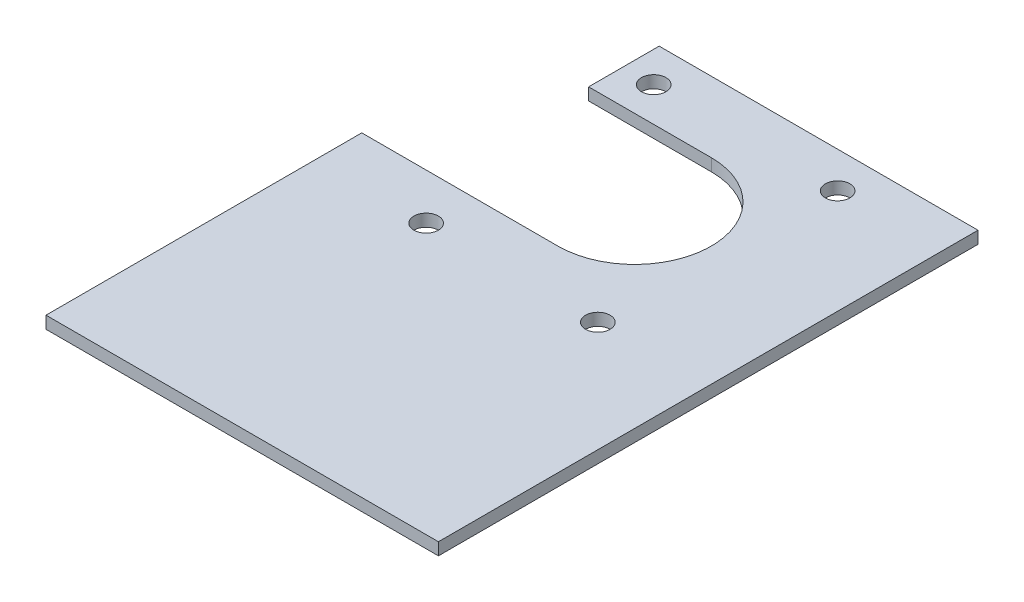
SolidWorks part; units mm, degrees
ref_plane "Front" through (0, 0, 0) normal (0, 0, 1) x (1, 0, 0)
ref_plane "Top" through (0, 0, 0) normal (0, 1, 0) x (1, 0, 0)
ref_plane "Right" through (0, 0, 0) normal (1, 0, 0) x (0, 0, -1)
sketch "Sketch1" plane through (0, 0, 0) normal (0, 1, 0) x (1, 0, 0)
  line L0 (25.4, 19.05) -> (-15.875, 19.05)
  line L2 (-25.4, -9.9219) -> (-25.4, -50.8)
  line L3 (-25.4, -50.8) -> (25.4, -50.8)
  line L4 (25.4, 19.05) -> (25.4, -50.8)
  line L5 (0, 0) -> (0, -50.8) construction
  line L6 (9.9219, 0) -> (15.875, 0) construction
  line L7 (0, -9.9219) -> (-25.4, -9.9219)
  line L10 (0, 9.9219) -> (-15.875, 9.9219)
  line L11 (-15.875, 9.9219) -> (-15.875, 19.05)
  line L12 (0, 15.875) -> (0, 9.9219) construction
  circle A0 centre (0, 0) radius 7.3025 construction
  arc A1 (0, -9.9219) -> (9.9219, 0) centre (0, 0) ccw
  arc A2 (15.875, 0) -> (-12.3924, 9.9219) centre (0, 0) ccw construction
  arc A3 (9.9219, 0) -> (0, 9.9219) centre (0, 0) ccw
  dimension "D4" = 14.605
  dimension "D5" = 19.8438
  dimension "D6" = 19.05
  dimension "D1" = 15.875
  dimension "D2" = 50.8
  dimension "D3" = 50.8
  dimension "D7" = 40.8781
extrude "Boss-Extrude1" add sketch "Sketch1" along normal blind 1.5875
sketch "Sketch2" plane through (0, 1.5875, 0) normal (0, 1, 0) x (1, 0, 0)
  circle A0 centre (0, 12.7) radius 0.127
  circle A1 centre (12.7, 0) radius 0.127
  circle A2 centre (0, 0) radius 12.7 construction
  dimension "D1" = 0.254
  dimension "D2" = 25.4
sketch "Sketch5" plane through (0, 1.5875, 0) normal (0, 1, 0) x (1, 0, 0)
  line L0 (25.4, 19.05) -> (-15.875, 19.05) construction
  circle A0 centre (11.9062, 14.3764) radius 1.5875
  circle A1 centre (-11.9063, 14.3764) radius 1.5875
  circle A4 centre (0, 0) radius 14.4217 construction
  circle A5 centre (11.1125, -15.875) radius 1.5875
  circle A6 centre (-11.1125, -15.875) radius 1.5875
  dimension "D1" = 3.175
  dimension "D6" = 3.175
  dimension "D2" = 4.6736
  dimension "D3" = 11.9062
  dimension "D4" = 11.9062
  dimension "D7" = 11.1125
  dimension "D8" = 11.1125
  dimension "D9" = 15.875
extrude "Cut-Extrude2" cut sketch "Sketch5" against normal through all
equation "\"Buoyancy\"=\"SW-Volume\"*(\"SW-Density\"-.037062)"
